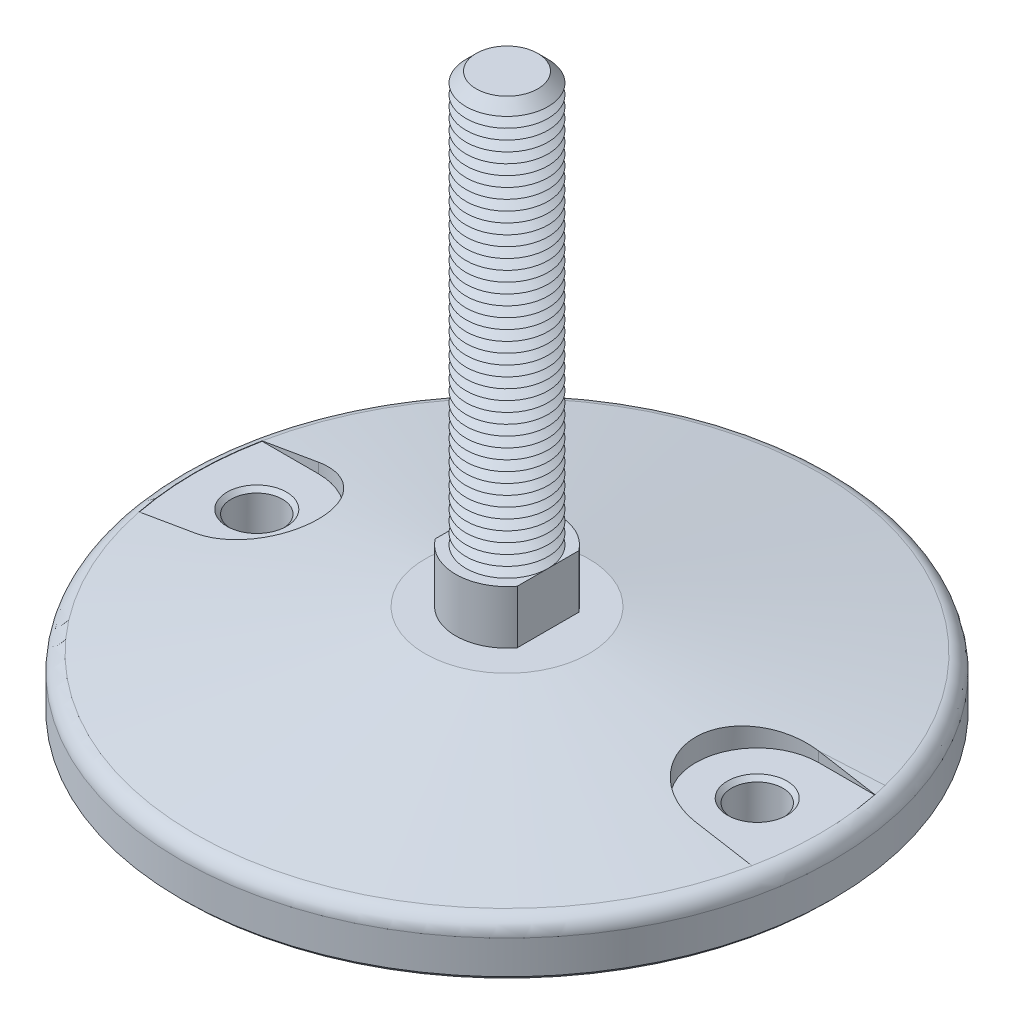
SolidWorks part; units mm, degrees
ref_plane "Front Plane" through (0, 0, 0) normal (0, 0, 1) x (1, 0, 0)
ref_plane "Top Plane" through (0, 0, 0) normal (0, 1, 0) x (1, 0, 0)
ref_plane "Right Plane" through (0, 0, 0) normal (1, 0, 0) x (0, 0, -1)
sketch "Sketch1" plane through (0, 0, 0) normal (1, 0, 0) x (0, 0, -1)
  line L0 (0, 61.3389) -> (0, -58.404) construction
sketch "Sketch2" plane through (0, 0, 0) normal (1, 0, 0) x (0, 0, -1)
  line L0 (0, 0) -> (-20, 0)
  line L1 (-20, 0) -> (-79.5, -10.4915)
  line L2 (-79.5, -10.4915) -> (-79.5, -23)
  line L3 (-79.5, -23) -> (0, -23)
  line L4 (0, 61.3389) -> (0, -58.404) construction
  line L5 (0, -23) -> (0, 0)
  dimension "D1" = 23
  dimension "D2" = 79.5
  dimension "D3" = 20
  dimension "D4" = 10
revolve "Revolve1" add sketch "Sketch2" angle 360 about L0
fillet "Fillet1" radius 4 1 edges at (0, -10.4915, 79.5)
sketch "Sketch3" plane through (0, 0, 0) normal (0, 1, 0) x (1, 0, 0)
  circle A0 centre (0, 0) radius 12.5
  dimension "D1" = 25
extrude "Boss-Extrude1" add sketch "Sketch3" along normal blind 13
sketch "Sketch4" plane through (0, 13, 0) normal (0, 1, 0) x (1, 0, 0)
  line L0 (-10, 7.5) -> (-10, -7.5)
  line L2 (10, -7.5) -> (10, 7.5)
  arc A0 (-10, 7.5) -> (-10, -7.5) centre (0, 0) ccw
  circle A1 centre (0, 0) radius 12.5 construction
  arc A2 (10, -7.5) -> (10, 7.5) centre (0, 0) ccw
  dimension "D1" = 20
extrude "Cut-Extrude1" cut sketch "Sketch4" against normal blind 13
sketch "Sketch5" plane through (0, 13, 0) normal (0, 1, 0) x (1, 0, 0)
  circle A0 centre (0, 0) radius 10
  dimension "D1" = 20
extrude "Boss-Extrude2" add sketch "Sketch5" along normal blind 100
chamfer "Chamfer1" distance 2.5 angle 45 1 edges at (0, 113, 10)
sketch "Sketch6" plane through (0, 0, 0) normal (1, 0, 0) x (0, 0, -1)
  line L0 (-10, 13) -> (-7.8349, 14.25)
  line L1 (-7.8349, 14.25) -> (-10, 15.5)
  line L2 (-10, 110.5) -> (-10, 13) construction
  line L3 (-10, 15.5) -> (-10, 13)
  dimension "D1" = 2.5
revolve "Cut-Revolve1" cut sketch "Sketch6" angle 360 about L0
pattern_linear "LPattern1" count 39 spacing 2.5 along (0, 1, 0) of "Cut-Revolve1"
sketch "Sketch8" plane through (0, 0, 0) normal (0, 1, 0) x (1, 0, 0)
  line L0 (-61, 15) -> (-74.7035, 15)
  line L1 (-61, -15) -> (-74.7035, -15)
  arc A1 (-74.7035, 15) -> (-74.7035, -15) centre (0, 0) ccw
  circle A2 centre (0, 0) radius 76.1946 construction
  arc A3 (-61, -15) -> (-61, 15) centre (-61, 0) ccw
  point P3 (-61, 0)
  point P11 (0, 0)
  dimension "D1" = 61
  dimension "D2" = 30
extrude "Cut-Extrude4" cut sketch "Sketch8" against normal blind 10
sketch "Sketch10" plane through (0, -10, 0) normal (0, 1, 0) x (1, 0, 0)
  circle A0 centre (-61, 0) radius 6.25
  dimension "D1" = 12.5
extrude "Cut-Extrude5" cut sketch "Sketch10" against normal up to surface (13 mm away)
chamfer "Chamfer2" distance 1 angle 45 2 edges at (-61, -23, -6.25) (-61, -10, 6.25)
mirror "Mirror1" about plane through (0, 0, 0) normal (1, 0, 0) of "Chamfer2", "Cut-Extrude5", "Cut-Extrude4"
chamfer "Chamfer3" distance 1 angle 45 1 edges at (0, -23, 79.5)
